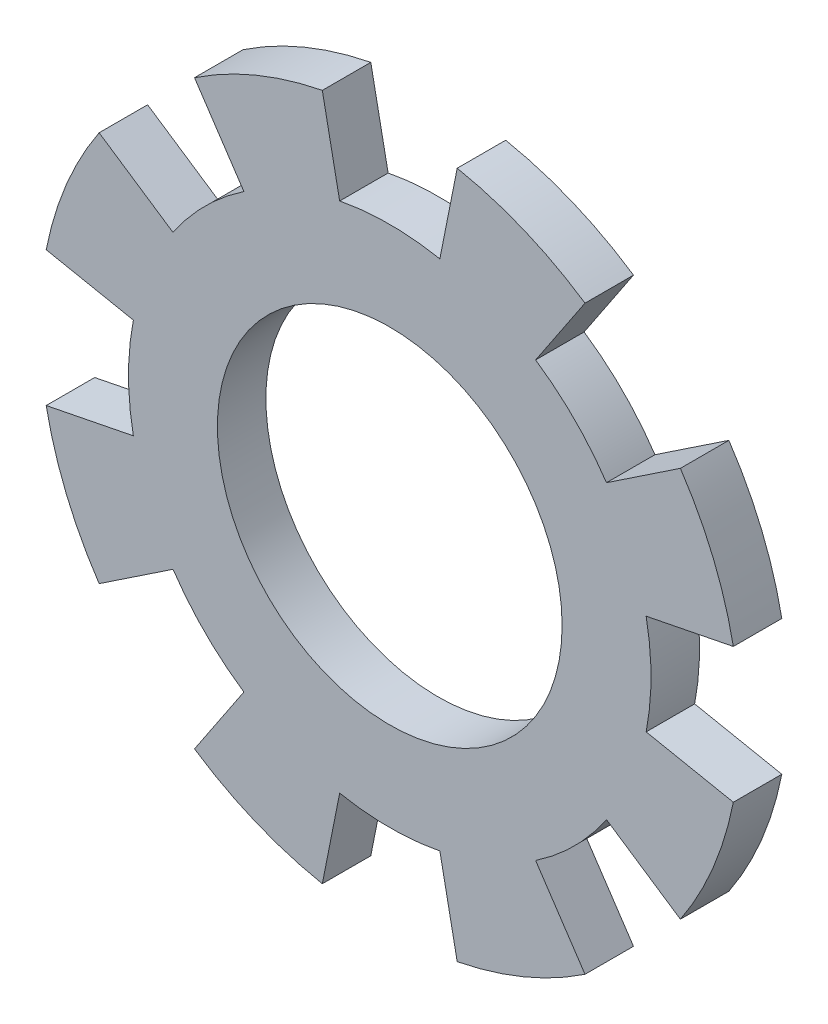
SolidWorks part; units mm, degrees
ref_plane "Front Plane" through (0, 0, 0) normal (0, 0, 1) x (1, 0, 0)
ref_plane "Top Plane" through (0, 0, 0) normal (0, 1, 0) x (1, 0, 0)
ref_plane "Right Plane" through (0, 0, 0) normal (1, 0, 0) x (0, 0, -1)
sketch "BodySke" plane through (0, 0, 0) normal (0, 1, 0) x (1, 0, 0)
  line L0 (0, 0) -> (0, 8) construction
  line L2 (1.6, 0) -> (3.25, 0)
  line L3 (1.6, 0) -> (1.6, 0.45)
  line L4 (1.6, 0.45) -> (3.25, 0.45)
  line L5 (3.25, 0) -> (3.25, 0.45)
  dimension "Inner_dia" = 3.2
  dimension "Outer_dia" = 6.5
  dimension "Thickness" = 0.45
  dimension "Num_tooth" = 8
revolve "BaseBody" add sketch "BodySke" angle 360 about L0
sketch "ToothSke" plane through (0, 0, 0) normal (0, 0, 1) x (1, 0, 0)
  line L0 (0, 0) -> (0, 2.7341) construction
  line L2 (-0.4651, 2.38) -> (-0.6381, 3.25)
  line L3 (0.6381, 3.25) -> (-0.6381, 3.25)
  line L4 (0.4651, 2.38) -> (0.6381, 3.25)
  circle A0 centre (0, 0) radius 2.425 construction
  arc A1 (-0.4651, 2.38) -> (0.4651, 2.38) centre (0, 0) cw
  circle A2 centre (0, 0) radius 1.6 construction
  circle A3 centre (0, 0) radius 1.6 construction
  circle A4 centre (0, 0) radius 3.25 construction
  point P11 (0, 1.083)
  point P12 (0, 2.425)
  point P15 (0, 2.4103)
  point P16 (0, 3.25)
  dimension "D1" = 4.85
  dimension "D2" = 1.2763
  dimension "D3" = 22.5
extrude "ToothCut" cut sketch "ToothSke" against normal through all
pattern_circular "ToothPat" count 8 over 360 about axis through (0, 0, 0) along (0, 0, 1) of "ToothCut"
equation "\"D1@ToothSke\" =  ( \"Inner_dia@BodySke\" + \"Outer_dia@BodySke\" )  / 2"
equation "\"D2@ToothSke\" =  pi  * \"Outer_dia@BodySke\" / 2 / \"Num_tooth@BodySke\""
equation "\"D3@ToothSke\" = 360 / 2 / \"Num_tooth@BodySke\" "
equation "\"Num_tooth@ToothPat\" = \"Num_tooth@BodySke\""
